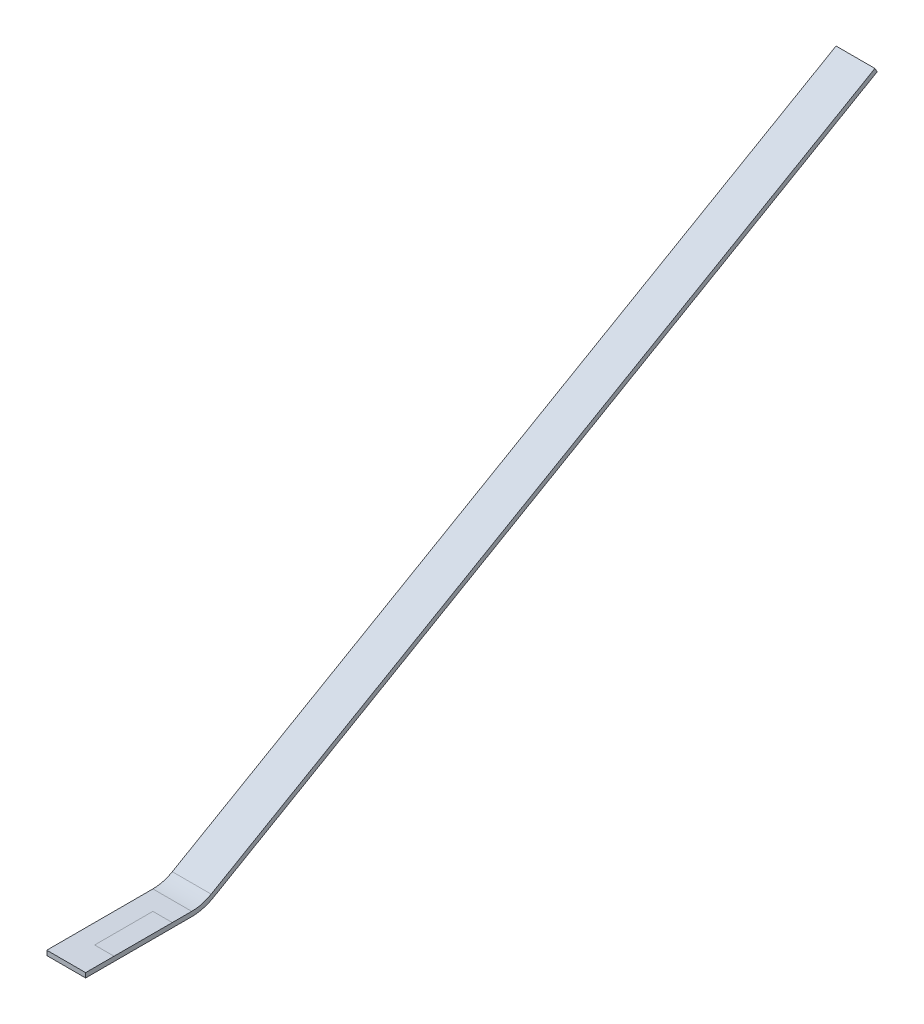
SolidWorks part; units mm, degrees
ref_plane "Front Plane" through (0, 0, 0) normal (0, 0, 1) x (1, 0, 0)
ref_plane "Top Plane" through (0, 0, 0) normal (0, 1, 0) x (1, 0, 0)
ref_plane "Right Plane" through (0, 0, 0) normal (1, 0, 0) x (0, 0, -1)
sketch "Sketch1" plane through (0, 0, 0) normal (1, 0, 0) x (0, 0, -1)
  line L0 (-38.1, 0) -> (-3.403, 0)
  line L1 (2.947, 1.7015) -> (219.9705, 127)
  arc A0 (-3.403, 0) -> (2.947, 1.7015) centre (-3.403, 12.7) ccw
  point P6 (0, 0)
  dimension "D4" = 12.7
  dimension "D1" = 38.1
  dimension "D2" = 150
  dimension "D3" = 254
extrude "Extrude-Thin1" add sketch "Sketch1" along normal mid plane 12.7 thin
sketch "Sketch2" plane through (0, 0, 0) normal (0, 1, 0) x (1, 0, 0)
  line L0 (6.35, -28.803) -> (0, -28.803)
  line L1 (6.35, -38.1) -> (6.35, -3.403) construction
  line L2 (0, -28.803) -> (0, -9.753)
  line L3 (0, -9.753) -> (6.35, -9.753)
  line L4 (6.35, -3.403) -> (-6.35, -3.403) construction
  dimension "D1" = 19.05
  dimension "D2" = 6.35
